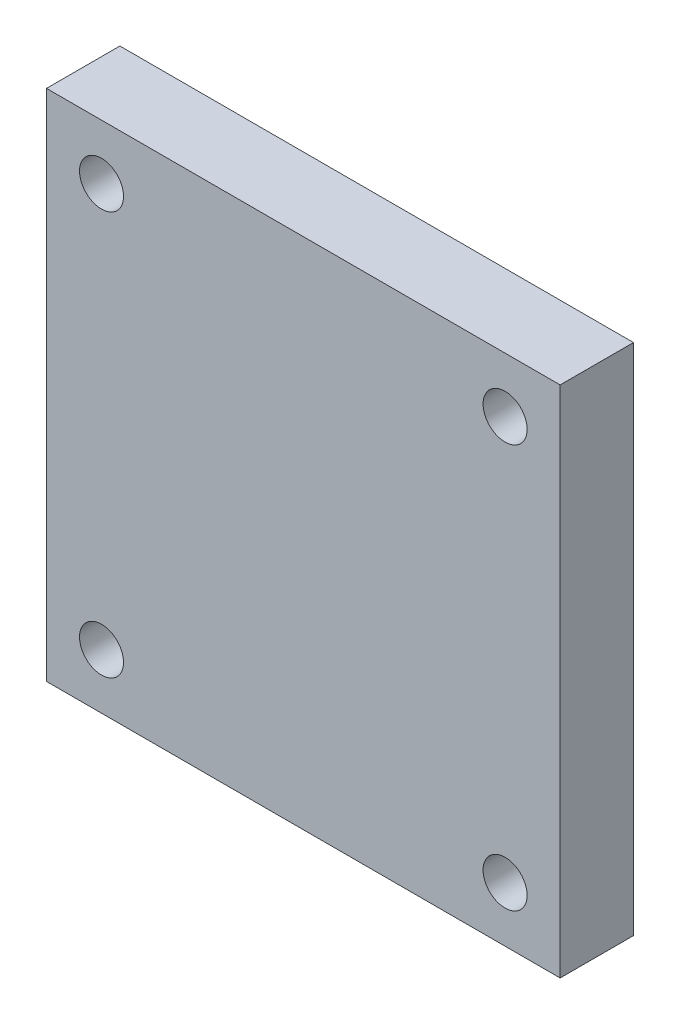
SolidWorks part; units mm, degrees
ref_plane "Plan de face" through (0, 0, 0) normal (0, 0, 1) x (1, 0, 0)
ref_plane "Plan de dessus" through (0, 0, 0) normal (0, 1, 0) x (1, 0, 0)
ref_plane "Plan de droite" through (0, 0, 0) normal (1, 0, 0) x (0, 0, -1)
sketch "Esquisse1" plane through (0, 0, 0) normal (0, 0, 1) x (1, 0, 0)
  line L0 (-87.2232, 0) -> (88.7549, 0) construction
  line L1 (-70, 70) -> (70, 70)
  line L2 (-70, 70) -> (-70, -70)
  line L3 (-70, -70) -> (70, -70)
  line L4 (70, 70) -> (70, -70)
  line L5 (0, 73.2675) -> (0, -75.48) construction
  line L6 (-66.4598, 55) -> (-41.782, 55) construction
  line L7 (-55, 66.4598) -> (-55, 34.1234) construction
  line L8 (-55, -33.4427) -> (-55, -65.2685) construction
  line L9 (-66.4598, -55) -> (-31.4004, -55) construction
  line L10 (66.4598, -55) -> (31.4004, -55) construction
  line L11 (55, -33.4427) -> (55, -65.2685) construction
  line L12 (55, 66.4598) -> (55, 34.1234) construction
  line L13 (66.4598, 55) -> (41.782, 55) construction
  circle A0 centre (-55, 55) radius 6
  circle A1 centre (-55, -55) radius 6
  circle A2 centre (55, -55) radius 6
  circle A3 centre (55, 55) radius 6
  dimension "D1" = 140
  dimension "D2" = 70
  dimension "D3" = 70
  dimension "D4" = 140
  dimension "D5" = 15
  dimension "D6" = 15
  dimension "D7" = 15
  dimension "D8" = 15
extrude "Boss.-Extru.1" add sketch "Esquisse1" along normal blind 20
